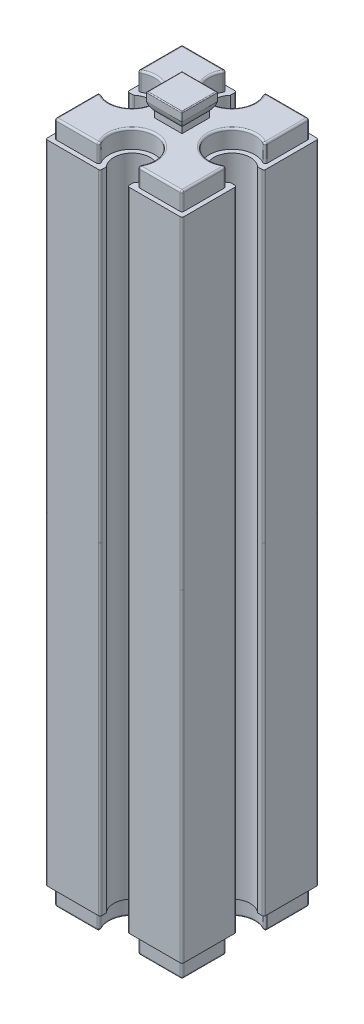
SolidWorks part; units mm, degrees
ref_plane "前视基准面" through (0, 0, 0) normal (0, 0, 1) x (1, 0, 0)
ref_plane "上视基准面" through (0, 0, 0) normal (0, 1, 0) x (1, 0, 0)
ref_plane "右视基准面" through (0, 0, 0) normal (1, 0, 0) x (0, 0, -1)
sketch "草图1" plane through (0, 0, 0) normal (0, 1, 0) x (1, 0, 0)
  line L0 (0, 0) -> (0, 7.5) construction
  line L1 (0, 0) -> (7.5, 0) construction
  line L2 (-7.5, 7.5) -> (-1.5, 7.5)
  line L3 (7.5, 7.5) -> (7.5, 1.5)
  line L4 (6.8229, 1.5) -> (7.5, 1.5)
  line L5 (6.8229, -1.5) -> (7.5, -1.5)
  line L6 (0, 7.5) -> (0, 5.5) construction
  line L7 (-1.5, 6.8229) -> (-1.5, 7.5)
  line L8 (1.5, 6.8229) -> (1.5, 7.5)
  line L9 (1.5, 7.5) -> (7.5, 7.5)
  line L10 (7.5, -1.5) -> (7.5, -7.5)
  line L11 (7.5, -7.5) -> (1.5, -7.5)
  line L12 (1.5, -6.8229) -> (1.5, -7.5)
  line L13 (-1.5, -6.8229) -> (-1.5, -7.5)
  line L14 (-1.5, -7.5) -> (-7.5, -7.5)
  line L15 (-7.5, -7.5) -> (-7.5, -1.5)
  line L16 (-6.8229, -1.5) -> (-7.5, -1.5)
  line L17 (-6.8229, 1.5) -> (-7.5, 1.5)
  line L18 (-7.5, 1.5) -> (-7.5, 7.5)
  arc A0 (-1.5, 6.8229) -> (1.5, 6.8229) centre (0, 5.5) ccw
  arc A1 (6.8229, 1.5) -> (6.8229, -1.5) centre (5.5, 0) ccw
  arc A2 (1.5, -6.8229) -> (-1.5, -6.8229) centre (0, -5.5) ccw
  arc A3 (-6.8229, -1.5) -> (-6.8229, 1.5) centre (-5.5, 0) ccw
  point P36 (0, 0)
  dimension "D6" = 4
  dimension "D7" = 2
  dimension "D1" = 7.5
  dimension "D2" = 7.5
  dimension "D3" = 2
  dimension "D4" = 7.5
  dimension "D5" = 1.5
extrude "凸台-拉伸1" add sketch "草图1" along normal blind 35.5
sketch "草图2" plane through (0, 35.5, 0) normal (0, 1, 0) x (1, 0, 0)
  line L0 (-7, 7) -> (-7, 2)
  line L1 (-7, 2) -> (-7, 2)
  line L2 (-7, -2) -> (-7, -2)
  line L3 (-7, -2) -> (-7, -7)
  line L4 (-7, -7) -> (-2, -7)
  line L5 (-2, -7) -> (-2, -7)
  line L6 (2, -7) -> (2, -7)
  line L7 (2, -7) -> (7, -7)
  line L8 (7, -7) -> (7, -2)
  line L9 (7, -2) -> (7, -2)
  line L10 (7, 2) -> (7, 2)
  line L11 (7, 2) -> (7, 7)
  line L12 (7, 7) -> (2, 7)
  line L13 (2, 7) -> (2, 7)
  line L14 (-2, 7) -> (-2, 7)
  line L15 (-2, 7) -> (-7, 7)
  line L16 (-7.5, 7.5) -> (-7.5, 1.5)
  line L17 (-7.5, 1.5) -> (-6.8229, 1.5)
  line L18 (-6.8229, -1.5) -> (-7.5, -1.5)
  line L19 (-7.5, -1.5) -> (-7.5, -7.5)
  line L20 (-7.5, -7.5) -> (-1.5, -7.5)
  line L21 (-1.5, -7.5) -> (-1.5, -6.8229)
  line L22 (1.5, -6.8229) -> (1.5, -7.5)
  line L23 (1.5, -7.5) -> (7.5, -7.5)
  line L24 (7.5, -7.5) -> (7.5, -1.5)
  line L25 (7.5, -1.5) -> (6.8229, -1.5)
  line L26 (6.8229, 1.5) -> (7.5, 1.5)
  line L27 (7.5, 1.5) -> (7.5, 7.5)
  line L28 (7.5, 7.5) -> (1.5, 7.5)
  line L29 (1.5, 7.5) -> (1.5, 6.8229)
  line L30 (-1.5, 6.8229) -> (-1.5, 7.5)
  line L31 (-1.5, 7.5) -> (-7.5, 7.5)
  line L32 (-7.5, 7.5) -> (-7.5, 1.5) construction
  line L33 (-7.5, 1.5) -> (-6.8229, 1.5) construction
  line L34 (-6.8229, -1.5) -> (-7.5, -1.5) construction
  line L35 (-7.5, -1.5) -> (-7.5, -7.5) construction
  line L36 (-7.5, -7.5) -> (-1.5, -7.5) construction
  line L37 (-1.5, -7.5) -> (-1.5, -6.8229) construction
  line L38 (1.5, -6.8229) -> (1.5, -7.5) construction
  line L39 (1.5, -7.5) -> (7.5, -7.5) construction
  line L40 (7.5, -7.5) -> (7.5, -1.5) construction
  line L41 (7.5, -1.5) -> (6.8229, -1.5) construction
  line L42 (6.8229, 1.5) -> (7.5, 1.5) construction
  line L43 (7.5, 1.5) -> (7.5, 7.5) construction
  line L44 (7.5, 7.5) -> (1.5, 7.5) construction
  line L45 (1.5, 7.5) -> (1.5, 6.8229) construction
  line L46 (-1.5, 6.8229) -> (-1.5, 7.5) construction
  line L47 (-1.5, 7.5) -> (-7.5, 7.5) construction
  arc A0 (-7, -2) -> (-7, 2) centre (-5.5, 0) ccw
  arc A1 (2, -7) -> (-2, -7) centre (0, -5.5) ccw
  arc A2 (7, 2) -> (7, -2) centre (5.5, 0) ccw
  arc A3 (-2, 7) -> (2, 7) centre (0, 5.5) ccw
  arc A4 (-6.8229, -1.5) -> (-6.8229, 1.5) centre (-5.5, 0) ccw
  arc A5 (1.5, -6.8229) -> (-1.5, -6.8229) centre (0, -5.5) ccw
  arc A6 (6.8229, 1.5) -> (6.8229, -1.5) centre (5.5, 0) ccw
  arc A7 (-1.5, 6.8229) -> (1.5, 6.8229) centre (0, 5.5) ccw
  arc A8 (-6.8229, -1.5) -> (-6.8229, 1.5) centre (-5.5, 0) ccw construction
  arc A9 (1.5, -6.8229) -> (-1.5, -6.8229) centre (0, -5.5) ccw construction
  arc A10 (6.8229, 1.5) -> (6.8229, -1.5) centre (5.5, 0) ccw construction
  arc A11 (-1.5, 6.8229) -> (1.5, 6.8229) centre (0, 5.5) ccw construction
  dimension "D1" = 0
  dimension "D2" = 0.5
extrude "凸台-拉伸2" add sketch "草图2" along normal blind 2
sketch "草图3" plane through (0, 0, 0) normal (1, 0, 0) x (0, 0, -1)
  line L0 (0, 37.5) -> (0, 39.5) construction
  line L1 (2.5, 37.5) -> (-2.5, 37.5) construction
  line L2 (0, 39.5) -> (0, 40) construction
  line L3 (-1.5, 37.5) -> (1.5, 37.5)
  line L4 (1.5, 37.5) -> (1.5, 38.1771)
  line L5 (-1.95, 40) -> (1.95, 40)
  line L6 (1.95, 40) -> (1.95, 39.0556)
  line L7 (-1.5, 37.5) -> (-1.5, 38.1771)
  line L8 (-1.95, 40) -> (-1.95, 39.0556)
  arc A0 (-1.5, 38.1771) -> (-1.95, 39.0556) centre (0, 39.5) cw
  arc A1 (1.5, 38.1771) -> (1.95, 39.0556) centre (0, 39.5) ccw
  dimension "D5" = 2
  dimension "D1" = 2
  dimension "D2" = 0.5
  dimension "D3" = 1.5
  dimension "D4" = 1.95
extrude "凸台-拉伸3" add sketch "草图3" along normal blind 2 and the other way blind 2
sketch "草图4" plane through (0, 0, 0) normal (0, 0, 1) x (1, 0, 0)
  line L0 (0, 37.5) -> (0, 39.5) construction
  line L2 (-2, 37.5) -> (2, 37.5) construction
  line L3 (0, 39.5) -> (0, 40) construction
  line L4 (-2, 40) -> (2, 40) construction
  line L5 (1.95, 40) -> (2, 40)
  line L6 (-1.95, 40) -> (-1.95, 39.0556)
  line L9 (-1.5, 37.5) -> (-1.5, 38.1771)
  line L10 (1.5, 37.5) -> (1.5, 38.1771)
  line L11 (1.95, 40) -> (1.95, 39.0556)
  line L12 (1.5, 37.5) -> (2, 37.5)
  line L13 (-2, 40) -> (-1.95, 40)
  line L14 (-2, 40) -> (-2, 37.5)
  line L15 (-2, 37.5) -> (-1.5, 37.5)
  line L16 (2, 40) -> (2, 37.5)
  arc A0 (-1.95, 39.0556) -> (-1.5, 38.1771) centre (0, 39.5) ccw
  arc A1 (1.95, 39.0556) -> (1.5, 38.1771) centre (0, 39.5) cw
  dimension "D1" = 2
  dimension "D2" = 1.5
  dimension "D3" = 1.95
fillet "圆角3" radius 0.2 13 edges at (-1.5, 17.75, -7.5) (1.5, 17.75, -7.5) (7.5, 17.75, -7.5) (7.5, 17.75, -1.5) (7.5, 17.75, 1.5) (7.5, 17.75, 7.5) (-1.5, 17.75, 7.5) (1.5, 17.75, 7.5) (-6.8229, 17.75, -1.5) (-7.5, 17.75, 7.5) (-7.5, 17.75, 1.5) (-7.5, 17.75, -1.5) (-7.5, 17.75, -7.5)
extrude "切除-拉伸1" cut sketch "草图4" against normal blind 3 and the other way blind 3
fillet "圆角4" radius 0.2 24 edges at (0, 37.5, 3) (-3, 37.5, 0) (0, 37.5, -3) (3, 37.5, 0) (7, 36.5, 2) (7, 36.5, -2) (2, 36.5, -7) (-2, 36.5, -7) (-7, 36.5, 2) (-7, 36.5, -2) (2, 36.5, 7) (-2, 36.5, 7) (7, 36.5, 7) (4.5, 37.5, 7) (7, 37.5, 4.5) (7, 37.5, -4.5) (7, 36.5, -7) (4.5, 37.5, -7) (-4.5, 37.5, -7) (-7, 36.5, -7) (-7, 37.5, -4.5) (-4.5, 37.5, 7) (-7, 37.5, 4.5) (-7, 36.5, 7)
fillet "圆角5" radius 0.1 4 edges at (0, 40, -1.95) (1.95, 40, 0) (0, 40, 1.95) (-1.95, 40, 0)
mirror "镜向1" of "圆角5", "圆角4", "切除-拉伸1", "圆角3", "凸台-拉伸3", "凸台-拉伸2", "凸台-拉伸1"
